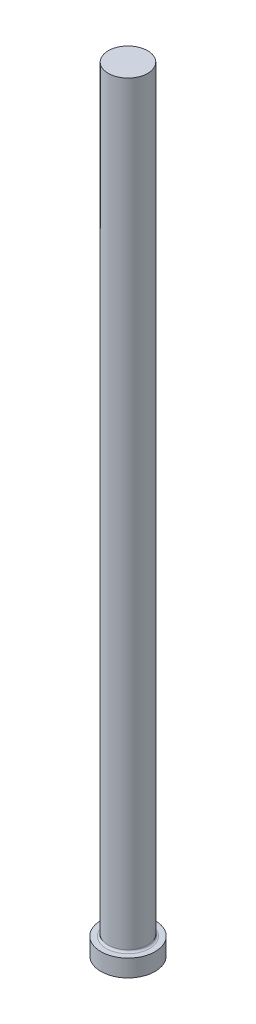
SolidWorks part; units mm, degrees
ref_plane "Plano frontal" through (0, 0, 0) normal (0, 0, 1) x (1, 0, 0)
ref_plane "Plano superior" through (0, 0, 0) normal (0, 1, 0) x (1, 0, 0)
ref_plane "Plano direito" through (0, 0, 0) normal (1, 0, 0) x (0, 0, -1)
sketch "Esboço1" plane through (0, 0, 0) normal (0, 0, 1) x (1, 0, 0)
  line L0 (0, 0) -> (11, 0)
  line L1 (11, 0) -> (11, 7)
  line L2 (11, 7) -> (8.8, 7)
  line L3 (8, 7.8) -> (8, 315)
  line L4 (8, 315) -> (0, 315)
  line L5 (0, 315) -> (0, 0) construction
  line L6 (0, 0) -> (0, 315)
  arc A0 (8.8, 7) -> (8, 7.8) centre (8.8, 7.8) cw
  dimension "D3" = 0.8
  dimension "D1" = 22
  dimension "D2" = 16
  dimension "D4" = 7
  dimension "D5" = 315
revolve "Revolução1" add sketch "Esboço1" angle 360 about L5
sketch "Esboço2"
  dimension "D1" = 0.825
  dimension "D2" = 1.925
  dimension "D3" = 1.2375
  dimension "D4" = 5.9125
wrap "Envolver1" sketch "Esboço2" wrap type deboss source sketch "Esboço2" thickness 0.1 parameters "D1"=0.1
